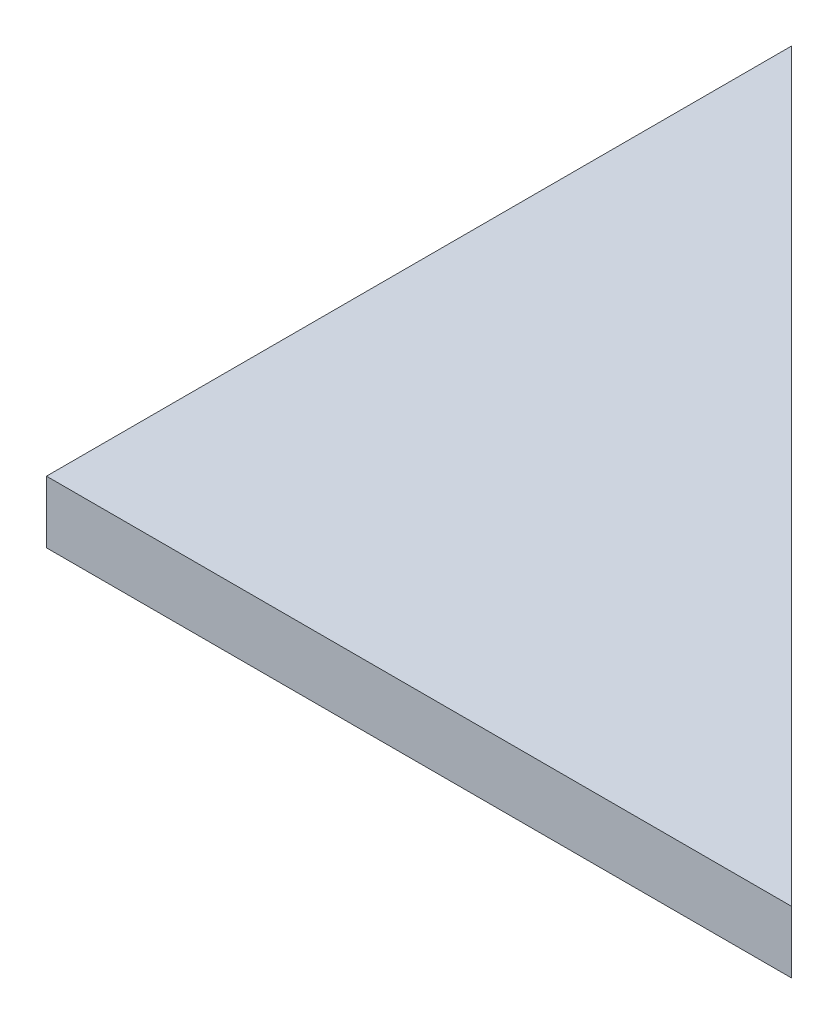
SolidWorks part; units mm, degrees
ref_plane "FRONT" through (0, 0, 0) normal (0, 0, 1) x (1, 0, 0)
ref_plane "TOP" through (0, 0, 0) normal (0, 1, 0) x (1, 0, 0)
ref_plane "RIGHT" through (0, 0, 0) normal (1, 0, 0) x (0, 0, -1)
sketch "Sketch1" plane through (0, 0, 0) normal (0, 1, 0) x (1, 0, 0)
  line L0 (0, 0) -> (0, 76.2)
  line L1 (0, 0) -> (76.2, 0)
  line L2 (76.2, 0) -> (0, 76.2)
  dimension "D1" = 76.2
  dimension "D2" = 76.2
extrude "Extrude1" add sketch "Sketch1" along normal mid plane 6.35
